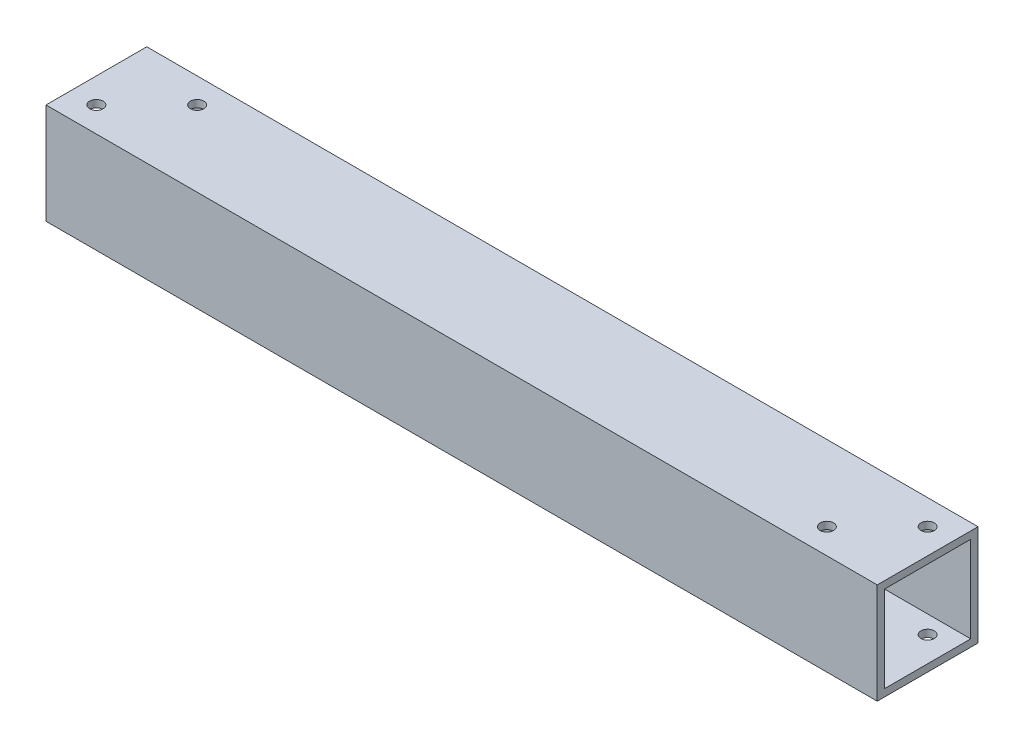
SolidWorks part; units mm, degrees
ref_plane "Front" through (0, 0, 0) normal (0, 0, 1) x (1, 0, 0)
ref_plane "Top" through (0, 0, 0) normal (0, 1, 0) x (1, 0, 0)
ref_plane "Right" through (0, 0, 0) normal (1, 0, 0) x (0, 0, -1)
sketch "Sketch1" plane through (0, 0, 0) normal (1, 0, 0) x (0, 0, -1)
  line L1 (0, 0) -> (50.8, 0)
  line L2 (0, 0) -> (0, 50.8)
  line L3 (0, 50.8) -> (50.8, 50.8)
  line L4 (50.8, 0) -> (50.8, 50.8)
  line L5 (3.6576, 47.1424) -> (47.1424, 47.1424)
  line L6 (3.6576, 47.1424) -> (3.6576, 3.6576)
  line L7 (3.6576, 3.6576) -> (47.1424, 3.6576)
  line L8 (47.1424, 47.1424) -> (47.1424, 3.6576)
  dimension "D1" = 50.8
  dimension "D2" = 50.8
  dimension "D3" = 3.6576
  dimension "D4" = 3.6576
  dimension "D5" = 3.6576
  dimension "D6" = 3.6576
extrude "Extrude1" add sketch "Sketch1" along normal blind 419.1
sketch "Sketch3" plane through (0, 50.8, 0) normal (0, 1, 0) x (1, 0, 0)
  line L0 (0, 50.8) -> (0, 0) construction
  line L1 (0, 25.4) -> (419.1, 25.4) construction
  line L2 (419.1, 50.8) -> (419.1, 0) construction
  circle A0 centre (12.7, 12.7) radius 3.3731
  circle A1 centre (38.1, 38.1) radius 3.3731
  circle A2 centre (406.4, 38.1) radius 3.3731
  circle A3 centre (381, 12.7) radius 3.3731
  dimension "D1" = 6.7462
  dimension "D7" = 25.4
  dimension "D8" = 12.7
  dimension "D9" = 12.7
  dimension "D2" = 12.7
  dimension "D3" = 38.1
  dimension "D4" = 12.7
  dimension "D5" = 25.4
  dimension "D6" = 12.7
extrude "Cut-Extrude1" cut sketch "Sketch3" against normal through all
